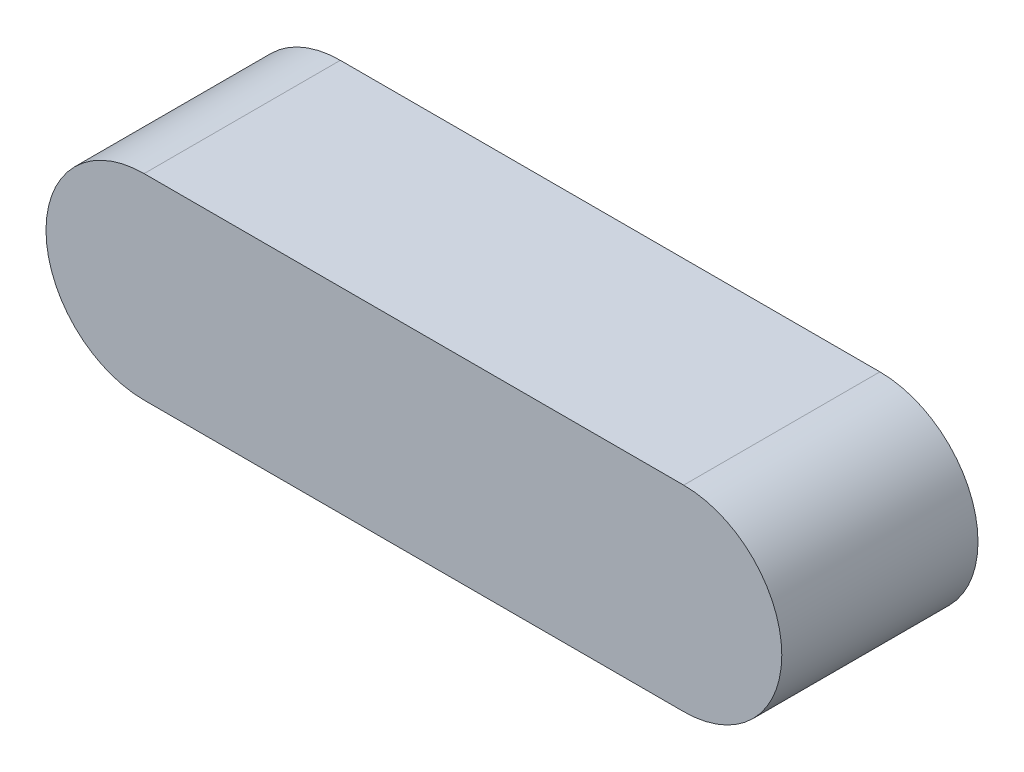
SolidWorks part; units mm, degrees
ref_plane "Plan1" through (0, 0, 0) normal (0, 0, 1) x (1, 0, 0)
ref_plane "Plan2" through (0, 0, 0) normal (0, 1, 0) x (1, 0, 0)
ref_plane "Plan3" through (0, 0, 0) normal (1, 0, 0) x (0, 0, -1)
sketch "Esquisse1" plane through (0, 0, 0) normal (0, 0, 1) x (1, 0, 0)
  line L0 (0, 2) -> (11, 2)
  line L1 (0, -2) -> (11, -2)
  arc A0 (0, 2) -> (0, -2) centre (0, 0) ccw
  arc A1 (11, -2) -> (11, 2) centre (11, 0) ccw
extrude "Base-Extrusion" add sketch "Esquisse1" along normal blind 4
